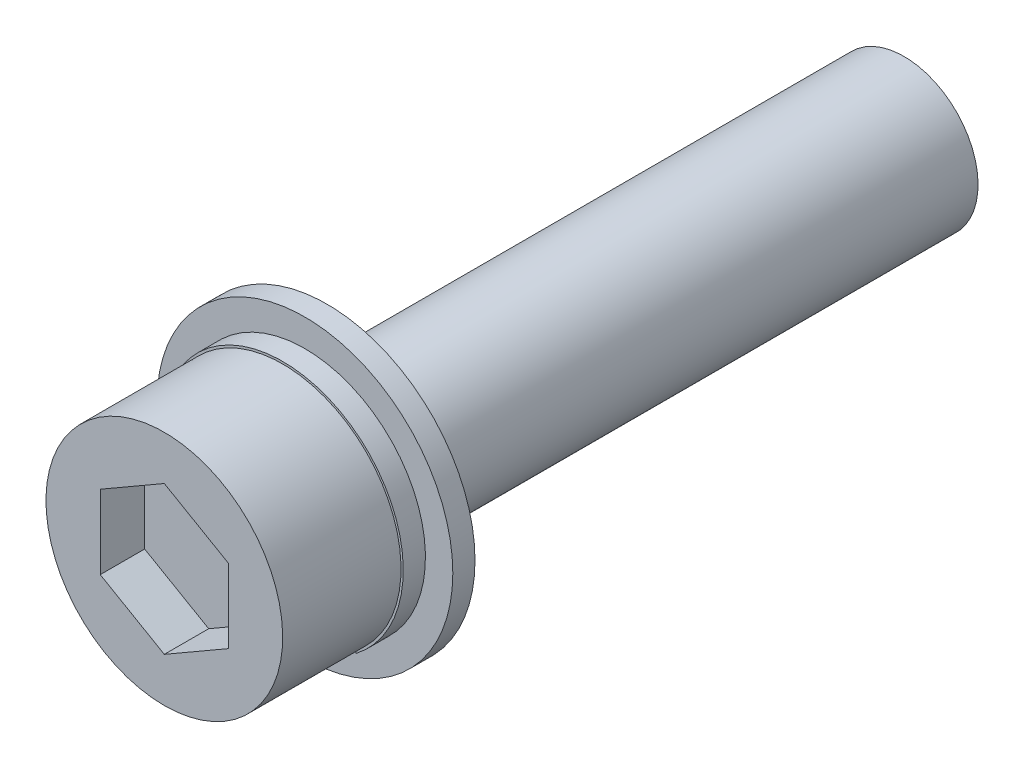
SolidWorks part; units mm, degrees
other "<Bracket Bolts>-<Boss-Extrude2>"
ref_plane "Front Plane" through (0, 0, 0) normal (0, 0, 1) x (1, 0, 0)
ref_plane "Top Plane" through (0, 0, 0) normal (0, 1, 0) x (1, 0, 0)
ref_plane "Right Plane" through (0, 0, 0) normal (1, 0, 0) x (0, 0, -1)
mirrored part "Bracket Bolts_Mirrored"
